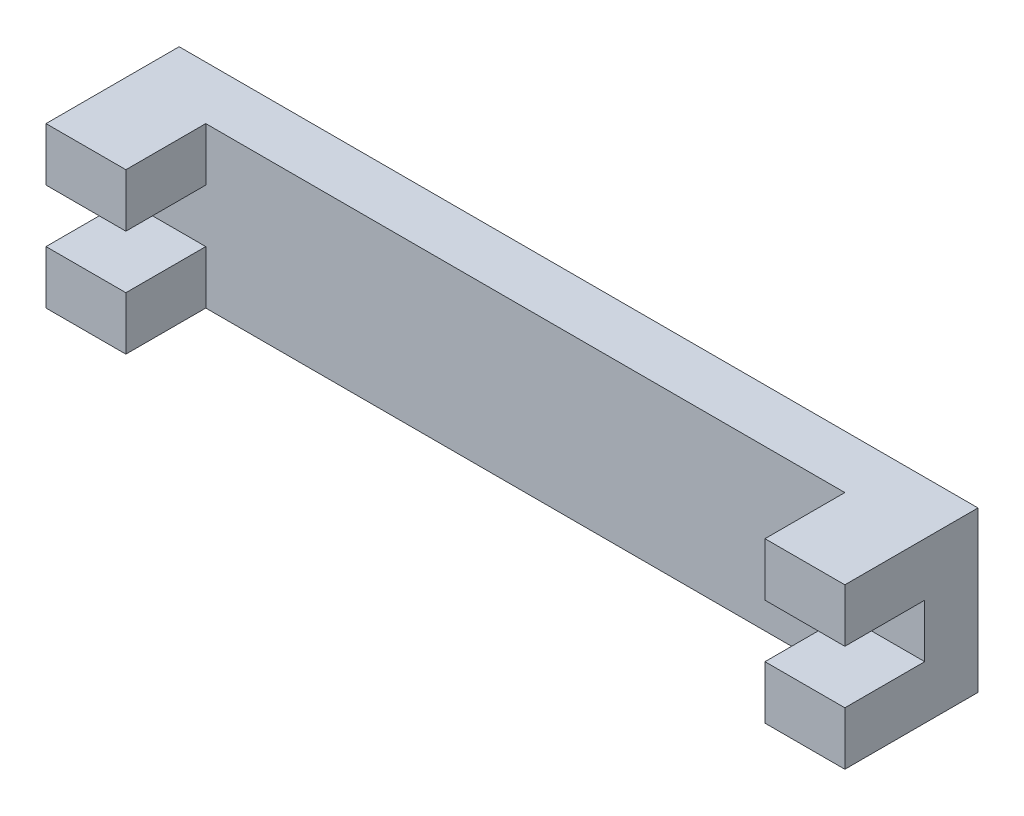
SolidWorks part; units mm, degrees
ref_plane "Ebene vorne" through (0, 0, 0) normal (0, 0, 1) x (1, 0, 0)
ref_plane "Ebene oben" through (0, 0, 0) normal (0, 1, 0) x (1, 0, 0)
ref_plane "Ebene rechts" through (0, 0, 0) normal (1, 0, 0) x (0, 0, -1)
sketch "Skizze1" plane through (0, 0, 0) normal (0, 0, 1) x (1, 0, 0)
  line L1 (0, 0) -> (30, 0)
  line L2 (0, 0) -> (0, 6)
  line L3 (0, 6) -> (30, 6)
  line L4 (30, 0) -> (30, 6)
  dimension "D1" = 30
  dimension "D2" = 6
extrude "Aufsatz-Linear austragen1" add sketch "Skizze1" along normal blind 2
sketch "Skizze2" plane through (0, 0, 2) normal (0, 0, 1) x (1, 0, 0)
  line L0 (15, 6) -> (15, 0) construction
  line L1 (0, 6) -> (3, 6)
  line L2 (0, 6) -> (0, 4)
  line L3 (0, 4) -> (3, 4)
  line L4 (3, 6) -> (3, 4)
  line L5 (0, 0) -> (3, 0)
  line L6 (0, 0) -> (0, 2)
  line L7 (0, 2) -> (3, 2)
  line L8 (3, 0) -> (3, 2)
  line L9 (30, 6) -> (0, 6) construction
  line L10 (0, 0) -> (30, 0) construction
  line L11 (30, 2) -> (27, 2)
  line L12 (27, 0) -> (27, 2)
  line L13 (30, 0) -> (27, 0)
  line L14 (30, 0) -> (30, 2)
  line L15 (30, 4) -> (27, 4)
  line L16 (27, 6) -> (27, 4)
  line L17 (30, 6) -> (27, 6)
  line L18 (30, 6) -> (30, 4)
  dimension "D1" = 2
  dimension "D2" = 2
  dimension "D3" = 3
  dimension "D4" = 3
extrude "Aufsatz-Linear austragen2" add sketch "Skizze2" along normal blind 3
